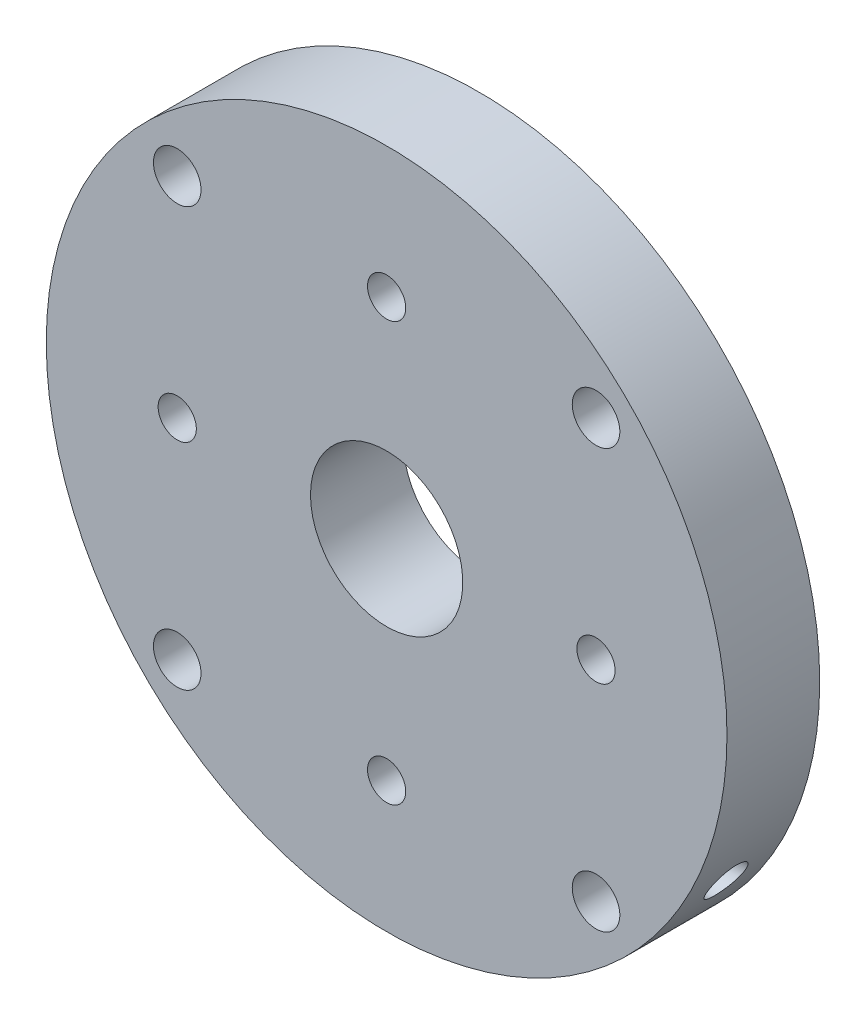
SolidWorks part; units mm, degrees
ref_plane "Plane1" through (0, 0, 0) normal (0, 0, 1) x (1, 0, 0)
ref_plane "Plane2" through (0, 0, 0) normal (0, 1, 0) x (1, 0, 0)
ref_plane "Plane3" through (0, 0, 0) normal (1, 0, 0) x (0, 0, -1)
imported_body "Imported1"
sketch "Sketch1" plane through (0, 0, -7.7343) normal (0, 0, -1) x (-1, 0, 0)
  circle A1 centre (-20.0041, -20.1374) radius 1.27
  dimension "D1" = 2.54
extrude "Boss-Extrude1" add sketch "Sketch1" along normal blind 2.54
